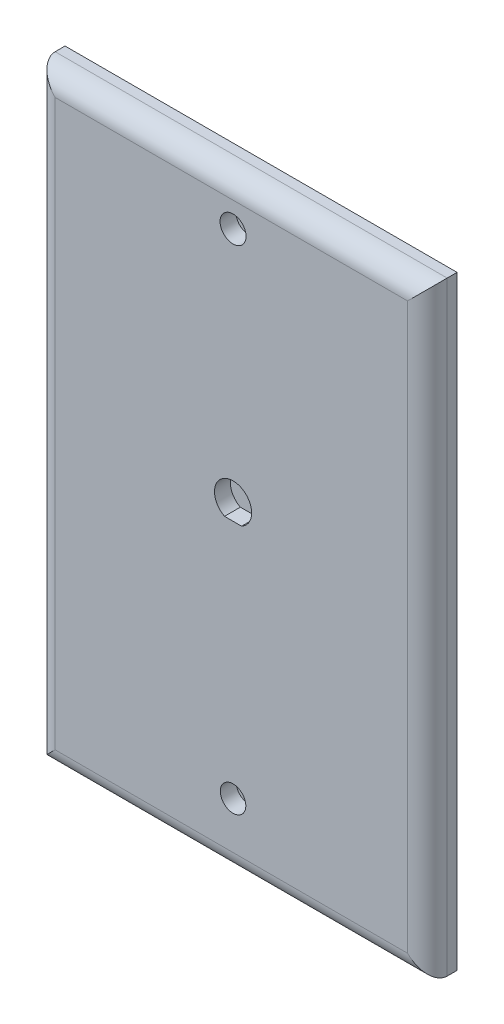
SolidWorks part; units mm, degrees
ref_plane "Front Plane" through (0, 0, 0) normal (0, 0, 1) x (1, 0, 0)
ref_plane "Top Plane" through (0, 0, 0) normal (0, 1, 0) x (1, 0, 0)
ref_plane "Right Plane" through (0, 0, 0) normal (1, 0, 0) x (0, 0, -1)
sketch "Sketch1" plane through (0, 0, 0) normal (0, 0, 1) x (1, 0, 0)
  line L0 (-114.429, -165.8718) -> (86.8035, 144.4404) construction
  line L1 (-114.429, 144.4404) -> (86.8035, 144.4404)
  line L2 (-114.429, 144.4404) -> (-114.429, -165.8718)
  line L3 (-114.429, -165.8718) -> (86.8035, -165.8718)
  line L4 (86.8035, 144.4404) -> (86.8035, -165.8718)
  point P4 (0, 0)
  point P5 (-5.1127, -100.8015)
  point P7 (52.1004, -6.1601)
  dimension "D1" = 52.1004
  dimension "D2" = 86.8035
  dimension "D3" = 5.1127
  dimension "D4" = 114.429
  dimension "D5" = 144.4404
  dimension "D6" = 6.1601
  dimension "D7" = 100.8015
  dimension "D8" = 165.8718
extrude "Extrude1" add sketch "Sketch1" along normal blind 15.24
sketch "Sketch2" plane through (0, 0, 15.24) normal (0, 0, 1) x (1, 0, 0)
  line L0 (-114.429, 144.4404) -> (-114.429, -165.8718) construction
  line L1 (-114.429, -165.8718) -> (86.8035, -165.8718) construction
  line L2 (-17.328, -8.4517) -> (-8.5429, -8.4517)
  circle A0 centre (-12.9354, 121.4837) radius 6.6727
  circle A1 centre (-12.9354, -131.7106) radius 6.5488
  arc A2 (-8.5429, -8.4517) -> (-17.328, -8.4517) centre (-12.9354, 0) ccw
  dimension "D1" = 13.3454
  dimension "D2" = 19.05
  dimension "D3" = 13.0977
  dimension "D4" = 101.4936
  dimension "D5" = 34.1611
  dimension "D6" = 165.8718
  dimension "D7" = 287.3555
extrude "Cut-Extrude1" cut sketch "Sketch2" against normal blind 8.128
fillet "Fillet1" radius 10.16 4 edges at (-114.429, -10.7157, 15.24) (-13.8128, -165.8718, 15.24) (86.8035, -10.7157, 15.24) (-13.8128, 144.4404, 15.24)
